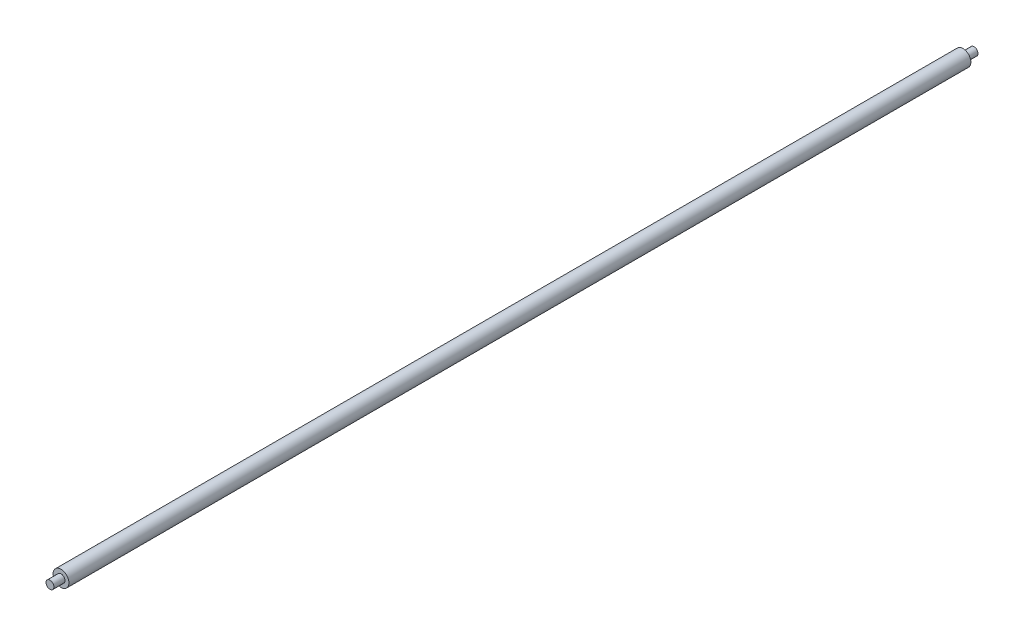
SolidWorks part; units mm, degrees
ref_plane "Ebene vorne" through (0, 0, 0) normal (0, 0, 1) x (1, 0, 0)
ref_plane "Ebene oben" through (0, 0, 0) normal (0, 1, 0) x (1, 0, 0)
ref_plane "Ebene rechts" through (0, 0, 0) normal (1, 0, 0) x (0, 0, -1)
sketch "Skizze1" plane through (0, 0, 0) normal (0, 0, 1) x (1, 0, 0)
  circle A0 centre (0, 0) radius 5
  dimension "D1" = 10
extrude "Aufsatz-Linear austragen1" add sketch "Skizze1" along normal blind 570
sketch "Skizze2" plane through (0, 0, 0) normal (0, 0, -1) x (-1, 0, 0)
  circle A0 centre (0, 0) radius 2.5
  dimension "D1" = 5
extrude "Aufsatz-Linear austragen2" add sketch "Skizze2" along normal blind 7
sketch "Skizze3" plane through (0, 0, 570) normal (0, 0, 1) x (1, 0, 0)
  circle A0 centre (0, 0) radius 2.5
  dimension "D1" = 5
extrude "Aufsatz-Linear austragen3" add sketch "Skizze3" along normal blind 7
